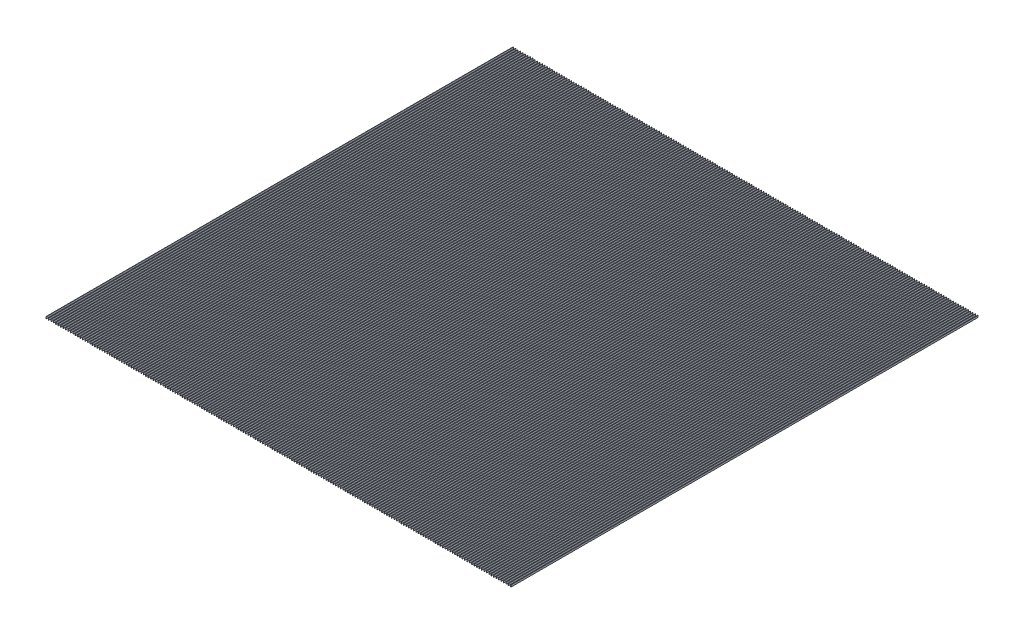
SolidWorks part; units mm, degrees
ref_plane "Front Plane" through (0, 0, 0) normal (0, 0, 1) x (1, 0, 0)
ref_plane "Top Plane" through (0, 0, 0) normal (0, 1, 0) x (1, 0, 0)
ref_plane "Right Plane" through (0, 0, 0) normal (1, 0, 0) x (0, 0, -1)
sketch "Sketch1" plane through (0, 0, 0) normal (0, 1, 0) x (1, 0, 0)
  line L0 (30.1625, 3048) -> (33.3375, 3048)
  line L1 (-1.5875, 3048) -> (1.5875, 3048)
  line L2 (-1.5875, 3048) -> (-1.5875, -3048)
  line L3 (-1.5875, -3048) -> (1.5875, -3048)
  line L4 (1.5875, 3048) -> (1.5875, -3048)
  line L5 (30.1625, 3048) -> (30.1625, -3048)
  line L6 (30.1625, -3048) -> (33.3375, -3048)
  line L7 (33.3375, 3048) -> (33.3375, -3048)
  line L8 (61.9125, 3048) -> (65.0875, 3048)
  line L9 (61.9125, 3048) -> (61.9125, -3048)
  line L10 (61.9125, -3048) -> (65.0875, -3048)
  line L11 (65.0875, 3048) -> (65.0875, -3048)
  line L12 (93.6625, 3048) -> (96.8375, 3048)
  line L13 (93.6625, 3048) -> (93.6625, -3048)
  line L14 (93.6625, -3048) -> (96.8375, -3048)
  line L15 (96.8375, 3048) -> (96.8375, -3048)
  line L16 (125.4125, 3048) -> (128.5875, 3048)
  line L17 (125.4125, 3048) -> (125.4125, -3048)
  line L18 (125.4125, -3048) -> (128.5875, -3048)
  line L19 (128.5875, 3048) -> (128.5875, -3048)
  line L20 (157.1625, 3048) -> (160.3375, 3048)
  line L21 (157.1625, 3048) -> (157.1625, -3048)
  line L22 (157.1625, -3048) -> (160.3375, -3048)
  line L23 (160.3375, 3048) -> (160.3375, -3048)
  line L24 (188.9125, 3048) -> (192.0875, 3048)
  line L25 (188.9125, 3048) -> (188.9125, -3048)
  line L26 (188.9125, -3048) -> (192.0875, -3048)
  line L27 (192.0875, 3048) -> (192.0875, -3048)
  line L28 (220.6625, 3048) -> (223.8375, 3048)
  line L29 (220.6625, 3048) -> (220.6625, -3048)
  line L30 (220.6625, -3048) -> (223.8375, -3048)
  line L31 (223.8375, 3048) -> (223.8375, -3048)
  line L32 (252.4125, 3048) -> (255.5875, 3048)
  line L33 (252.4125, 3048) -> (252.4125, -3048)
  line L34 (252.4125, -3048) -> (255.5875, -3048)
  line L35 (255.5875, 3048) -> (255.5875, -3048)
  line L36 (284.1625, 3048) -> (287.3375, 3048)
  line L37 (284.1625, 3048) -> (284.1625, -3048)
  line L38 (284.1625, -3048) -> (287.3375, -3048)
  line L39 (287.3375, 3048) -> (287.3375, -3048)
  line L40 (315.9125, 3048) -> (319.0875, 3048)
  line L41 (315.9125, 3048) -> (315.9125, -3048)
  line L42 (315.9125, -3048) -> (319.0875, -3048)
  line L43 (319.0875, 3048) -> (319.0875, -3048)
  line L44 (347.6625, 3048) -> (350.8375, 3048)
  line L45 (347.6625, 3048) -> (347.6625, -3048)
  line L46 (347.6625, -3048) -> (350.8375, -3048)
  line L47 (350.8375, 3048) -> (350.8375, -3048)
  line L48 (379.4125, 3048) -> (382.5875, 3048)
  line L49 (379.4125, 3048) -> (379.4125, -3048)
  line L50 (379.4125, -3048) -> (382.5875, -3048)
  line L51 (382.5875, 3048) -> (382.5875, -3048)
  line L52 (411.1625, 3048) -> (414.3375, 3048)
  line L53 (411.1625, 3048) -> (411.1625, -3048)
  line L54 (411.1625, -3048) -> (414.3375, -3048)
  line L55 (414.3375, 3048) -> (414.3375, -3048)
  line L56 (442.9125, 3048) -> (446.0875, 3048)
  line L57 (442.9125, 3048) -> (442.9125, -3048)
  line L58 (442.9125, -3048) -> (446.0875, -3048)
  line L59 (446.0875, 3048) -> (446.0875, -3048)
  line L60 (474.6625, 3048) -> (477.8375, 3048)
  line L61 (474.6625, 3048) -> (474.6625, -3048)
  line L62 (474.6625, -3048) -> (477.8375, -3048)
  line L63 (477.8375, 3048) -> (477.8375, -3048)
  line L64 (506.4125, 3048) -> (509.5875, 3048)
  line L65 (506.4125, 3048) -> (506.4125, -3048)
  line L66 (506.4125, -3048) -> (509.5875, -3048)
  line L67 (509.5875, 3048) -> (509.5875, -3048)
  line L68 (538.1625, 3048) -> (541.3375, 3048)
  line L69 (538.1625, 3048) -> (538.1625, -3048)
  line L70 (538.1625, -3048) -> (541.3375, -3048)
  line L71 (541.3375, 3048) -> (541.3375, -3048)
  line L72 (569.9125, 3048) -> (573.0875, 3048)
  line L73 (569.9125, 3048) -> (569.9125, -3048)
  line L74 (569.9125, -3048) -> (573.0875, -3048)
  line L75 (573.0875, 3048) -> (573.0875, -3048)
  line L76 (601.6625, 3048) -> (604.8375, 3048)
  line L77 (601.6625, 3048) -> (601.6625, -3048)
  line L78 (601.6625, -3048) -> (604.8375, -3048)
  line L79 (604.8375, 3048) -> (604.8375, -3048)
  line L80 (633.4125, 3048) -> (636.5875, 3048)
  line L81 (633.4125, 3048) -> (633.4125, -3048)
  line L82 (633.4125, -3048) -> (636.5875, -3048)
  line L83 (636.5875, 3048) -> (636.5875, -3048)
  line L84 (665.1625, 3048) -> (668.3375, 3048)
  line L85 (665.1625, 3048) -> (665.1625, -3048)
  line L86 (665.1625, -3048) -> (668.3375, -3048)
  line L87 (668.3375, 3048) -> (668.3375, -3048)
  line L88 (696.9125, 3048) -> (700.0875, 3048)
  line L89 (696.9125, 3048) -> (696.9125, -3048)
  line L90 (696.9125, -3048) -> (700.0875, -3048)
  line L91 (700.0875, 3048) -> (700.0875, -3048)
  line L92 (728.6625, 3048) -> (731.8375, 3048)
  line L93 (728.6625, 3048) -> (728.6625, -3048)
  line L94 (728.6625, -3048) -> (731.8375, -3048)
  line L95 (731.8375, 3048) -> (731.8375, -3048)
  line L96 (760.4125, 3048) -> (763.5875, 3048)
  line L97 (760.4125, 3048) -> (760.4125, -3048)
  line L98 (760.4125, -3048) -> (763.5875, -3048)
  line L99 (763.5875, 3048) -> (763.5875, -3048)
  line L100 (792.1625, 3048) -> (795.3375, 3048)
  line L101 (792.1625, 3048) -> (792.1625, -3048)
  line L102 (792.1625, -3048) -> (795.3375, -3048)
  line L103 (795.3375, 3048) -> (795.3375, -3048)
  line L104 (823.9125, 3048) -> (827.0875, 3048)
  line L105 (823.9125, 3048) -> (823.9125, -3048)
  line L106 (823.9125, -3048) -> (827.0875, -3048)
  line L107 (827.0875, 3048) -> (827.0875, -3048)
  line L108 (855.6625, 3048) -> (858.8375, 3048)
  line L109 (855.6625, 3048) -> (855.6625, -3048)
  line L110 (855.6625, -3048) -> (858.8375, -3048)
  line L111 (858.8375, 3048) -> (858.8375, -3048)
  line L112 (887.4125, 3048) -> (890.5875, 3048)
  line L113 (887.4125, 3048) -> (887.4125, -3048)
  line L114 (887.4125, -3048) -> (890.5875, -3048)
  line L115 (890.5875, 3048) -> (890.5875, -3048)
  line L116 (919.1625, 3048) -> (922.3375, 3048)
  line L117 (919.1625, 3048) -> (919.1625, -3048)
  line L118 (919.1625, -3048) -> (922.3375, -3048)
  line L119 (922.3375, 3048) -> (922.3375, -3048)
  line L120 (950.9125, 3048) -> (954.0875, 3048)
  line L121 (950.9125, 3048) -> (950.9125, -3048)
  line L122 (950.9125, -3048) -> (954.0875, -3048)
  line L123 (954.0875, 3048) -> (954.0875, -3048)
  line L124 (982.6625, 3048) -> (985.8375, 3048)
  line L125 (982.6625, 3048) -> (982.6625, -3048)
  line L126 (982.6625, -3048) -> (985.8375, -3048)
  line L127 (985.8375, 3048) -> (985.8375, -3048)
  line L128 (1014.4125, 3048) -> (1017.5875, 3048)
  line L129 (1014.4125, 3048) -> (1014.4125, -3048)
  line L130 (1014.4125, -3048) -> (1017.5875, -3048)
  line L131 (1017.5875, 3048) -> (1017.5875, -3048)
  line L132 (1046.1625, 3048) -> (1049.3375, 3048)
  line L133 (1046.1625, 3048) -> (1046.1625, -3048)
  line L134 (1046.1625, -3048) -> (1049.3375, -3048)
  line L135 (1049.3375, 3048) -> (1049.3375, -3048)
  line L136 (1077.9125, 3048) -> (1081.0875, 3048)
  line L137 (1077.9125, 3048) -> (1077.9125, -3048)
  line L138 (1077.9125, -3048) -> (1081.0875, -3048)
  line L139 (1081.0875, 3048) -> (1081.0875, -3048)
  line L140 (1109.6625, 3048) -> (1112.8375, 3048)
  line L141 (1109.6625, 3048) -> (1109.6625, -3048)
  line L142 (1109.6625, -3048) -> (1112.8375, -3048)
  line L143 (1112.8375, 3048) -> (1112.8375, -3048)
  line L144 (1141.4125, 3048) -> (1144.5875, 3048)
  line L145 (1141.4125, 3048) -> (1141.4125, -3048)
  line L146 (1141.4125, -3048) -> (1144.5875, -3048)
  line L147 (1144.5875, 3048) -> (1144.5875, -3048)
  line L148 (1173.1625, 3048) -> (1176.3375, 3048)
  line L149 (1173.1625, 3048) -> (1173.1625, -3048)
  line L150 (1173.1625, -3048) -> (1176.3375, -3048)
  line L151 (1176.3375, 3048) -> (1176.3375, -3048)
  line L152 (1204.9125, 3048) -> (1208.0875, 3048)
  line L153 (1204.9125, 3048) -> (1204.9125, -3048)
  line L154 (1204.9125, -3048) -> (1208.0875, -3048)
  line L155 (1208.0875, 3048) -> (1208.0875, -3048)
  line L156 (1236.6625, 3048) -> (1239.8375, 3048)
  line L157 (1236.6625, 3048) -> (1236.6625, -3048)
  line L158 (1236.6625, -3048) -> (1239.8375, -3048)
  line L159 (1239.8375, 3048) -> (1239.8375, -3048)
  line L160 (1268.4125, 3048) -> (1271.5875, 3048)
  line L161 (1268.4125, 3048) -> (1268.4125, -3048)
  line L162 (1268.4125, -3048) -> (1271.5875, -3048)
  line L163 (1271.5875, 3048) -> (1271.5875, -3048)
  line L164 (1300.1625, 3048) -> (1303.3375, 3048)
  line L165 (1300.1625, 3048) -> (1300.1625, -3048)
  line L166 (1300.1625, -3048) -> (1303.3375, -3048)
  line L167 (1303.3375, 3048) -> (1303.3375, -3048)
  line L168 (1331.9125, 3048) -> (1335.0875, 3048)
  line L169 (1331.9125, 3048) -> (1331.9125, -3048)
  line L170 (1331.9125, -3048) -> (1335.0875, -3048)
  line L171 (1335.0875, 3048) -> (1335.0875, -3048)
  line L172 (1363.6625, 3048) -> (1366.8375, 3048)
  line L173 (1363.6625, 3048) -> (1363.6625, -3048)
  line L174 (1363.6625, -3048) -> (1366.8375, -3048)
  line L175 (1366.8375, 3048) -> (1366.8375, -3048)
  line L176 (1395.4125, 3048) -> (1398.5875, 3048)
  line L177 (1395.4125, 3048) -> (1395.4125, -3048)
  line L178 (1395.4125, -3048) -> (1398.5875, -3048)
  line L179 (1398.5875, 3048) -> (1398.5875, -3048)
  line L180 (1427.1625, 3048) -> (1430.3375, 3048)
  line L181 (1427.1625, 3048) -> (1427.1625, -3048)
  line L182 (1427.1625, -3048) -> (1430.3375, -3048)
  line L183 (1430.3375, 3048) -> (1430.3375, -3048)
  line L184 (1458.9125, 3048) -> (1462.0875, 3048)
  line L185 (1458.9125, 3048) -> (1458.9125, -3048)
  line L186 (1458.9125, -3048) -> (1462.0875, -3048)
  line L187 (1462.0875, 3048) -> (1462.0875, -3048)
  line L188 (1490.6625, 3048) -> (1493.8375, 3048)
  line L189 (1490.6625, 3048) -> (1490.6625, -3048)
  line L190 (1490.6625, -3048) -> (1493.8375, -3048)
  line L191 (1493.8375, 3048) -> (1493.8375, -3048)
  line L192 (1522.4125, 3048) -> (1525.5875, 3048)
  line L193 (1522.4125, 3048) -> (1522.4125, -3048)
  line L194 (1522.4125, -3048) -> (1525.5875, -3048)
  line L195 (1525.5875, 3048) -> (1525.5875, -3048)
  line L196 (1554.1625, 3048) -> (1557.3375, 3048)
  line L197 (1554.1625, 3048) -> (1554.1625, -3048)
  line L198 (1554.1625, -3048) -> (1557.3375, -3048)
  line L199 (1557.3375, 3048) -> (1557.3375, -3048)
  line L200 (1585.9125, 3048) -> (1589.0875, 3048)
  line L201 (1585.9125, 3048) -> (1585.9125, -3048)
  line L202 (1585.9125, -3048) -> (1589.0875, -3048)
  line L203 (1589.0875, 3048) -> (1589.0875, -3048)
  line L204 (1617.6625, 3048) -> (1620.8375, 3048)
  line L205 (1617.6625, 3048) -> (1617.6625, -3048)
  line L206 (1617.6625, -3048) -> (1620.8375, -3048)
  line L207 (1620.8375, 3048) -> (1620.8375, -3048)
  line L208 (1649.4125, 3048) -> (1652.5875, 3048)
  line L209 (1649.4125, 3048) -> (1649.4125, -3048)
  line L210 (1649.4125, -3048) -> (1652.5875, -3048)
  line L211 (1652.5875, 3048) -> (1652.5875, -3048)
  line L212 (1681.1625, 3048) -> (1684.3375, 3048)
  line L213 (1681.1625, 3048) -> (1681.1625, -3048)
  line L214 (1681.1625, -3048) -> (1684.3375, -3048)
  line L215 (1684.3375, 3048) -> (1684.3375, -3048)
  line L216 (1712.9125, 3048) -> (1716.0875, 3048)
  line L217 (1712.9125, 3048) -> (1712.9125, -3048)
  line L218 (1712.9125, -3048) -> (1716.0875, -3048)
  line L219 (1716.0875, 3048) -> (1716.0875, -3048)
  line L220 (1744.6625, 3048) -> (1747.8375, 3048)
  line L221 (1744.6625, 3048) -> (1744.6625, -3048)
  line L222 (1744.6625, -3048) -> (1747.8375, -3048)
  line L223 (1747.8375, 3048) -> (1747.8375, -3048)
  line L224 (1776.4125, 3048) -> (1779.5875, 3048)
  line L225 (1776.4125, 3048) -> (1776.4125, -3048)
  line L226 (1776.4125, -3048) -> (1779.5875, -3048)
  line L227 (1779.5875, 3048) -> (1779.5875, -3048)
  line L228 (1808.1625, 3048) -> (1811.3375, 3048)
  line L229 (1808.1625, 3048) -> (1808.1625, -3048)
  line L230 (1808.1625, -3048) -> (1811.3375, -3048)
  line L231 (1811.3375, 3048) -> (1811.3375, -3048)
  line L232 (1839.9125, 3048) -> (1843.0875, 3048)
  line L233 (1839.9125, 3048) -> (1839.9125, -3048)
  line L234 (1839.9125, -3048) -> (1843.0875, -3048)
  line L235 (1843.0875, 3048) -> (1843.0875, -3048)
  line L236 (1871.6625, 3048) -> (1874.8375, 3048)
  line L237 (1871.6625, 3048) -> (1871.6625, -3048)
  line L238 (1871.6625, -3048) -> (1874.8375, -3048)
  line L239 (1874.8375, 3048) -> (1874.8375, -3048)
  line L240 (1903.4125, 3048) -> (1906.5875, 3048)
  line L241 (1903.4125, 3048) -> (1903.4125, -3048)
  line L242 (1903.4125, -3048) -> (1906.5875, -3048)
  line L243 (1906.5875, 3048) -> (1906.5875, -3048)
  line L244 (1935.1625, 3048) -> (1938.3375, 3048)
  line L245 (1935.1625, 3048) -> (1935.1625, -3048)
  line L246 (1935.1625, -3048) -> (1938.3375, -3048)
  line L247 (1938.3375, 3048) -> (1938.3375, -3048)
  line L248 (1966.9125, 3048) -> (1970.0875, 3048)
  line L249 (1966.9125, 3048) -> (1966.9125, -3048)
  line L250 (1966.9125, -3048) -> (1970.0875, -3048)
  line L251 (1970.0875, 3048) -> (1970.0875, -3048)
  line L252 (1998.6625, 3048) -> (2001.8375, 3048)
  line L253 (1998.6625, 3048) -> (1998.6625, -3048)
  line L254 (1998.6625, -3048) -> (2001.8375, -3048)
  line L255 (2001.8375, 3048) -> (2001.8375, -3048)
  line L256 (2030.4125, 3048) -> (2033.5875, 3048)
  line L257 (2030.4125, 3048) -> (2030.4125, -3048)
  line L258 (2030.4125, -3048) -> (2033.5875, -3048)
  line L259 (2033.5875, 3048) -> (2033.5875, -3048)
  line L260 (2062.1625, 3048) -> (2065.3375, 3048)
  line L261 (2062.1625, 3048) -> (2062.1625, -3048)
  line L262 (2062.1625, -3048) -> (2065.3375, -3048)
  line L263 (2065.3375, 3048) -> (2065.3375, -3048)
  line L264 (2093.9125, 3048) -> (2097.0875, 3048)
  line L265 (2093.9125, 3048) -> (2093.9125, -3048)
  line L266 (2093.9125, -3048) -> (2097.0875, -3048)
  line L267 (2097.0875, 3048) -> (2097.0875, -3048)
  line L268 (2125.6625, 3048) -> (2128.8375, 3048)
  line L269 (2125.6625, 3048) -> (2125.6625, -3048)
  line L270 (2125.6625, -3048) -> (2128.8375, -3048)
  line L271 (2128.8375, 3048) -> (2128.8375, -3048)
  line L272 (2157.4125, 3048) -> (2160.5875, 3048)
  line L273 (2157.4125, 3048) -> (2157.4125, -3048)
  line L274 (2157.4125, -3048) -> (2160.5875, -3048)
  line L275 (2160.5875, 3048) -> (2160.5875, -3048)
  line L276 (2189.1625, 3048) -> (2192.3375, 3048)
  line L277 (2189.1625, 3048) -> (2189.1625, -3048)
  line L278 (2189.1625, -3048) -> (2192.3375, -3048)
  line L279 (2192.3375, 3048) -> (2192.3375, -3048)
  line L280 (2220.9125, 3048) -> (2224.0875, 3048)
  line L281 (2220.9125, 3048) -> (2220.9125, -3048)
  line L282 (2220.9125, -3048) -> (2224.0875, -3048)
  line L283 (2224.0875, 3048) -> (2224.0875, -3048)
  line L284 (2252.6625, 3048) -> (2255.8375, 3048)
  line L285 (2252.6625, 3048) -> (2252.6625, -3048)
  line L286 (2252.6625, -3048) -> (2255.8375, -3048)
  line L287 (2255.8375, 3048) -> (2255.8375, -3048)
  line L288 (2284.4125, 3048) -> (2287.5875, 3048)
  line L289 (2284.4125, 3048) -> (2284.4125, -3048)
  line L290 (2284.4125, -3048) -> (2287.5875, -3048)
  line L291 (2287.5875, 3048) -> (2287.5875, -3048)
  line L292 (2316.1625, 3048) -> (2319.3375, 3048)
  line L293 (2316.1625, 3048) -> (2316.1625, -3048)
  line L294 (2316.1625, -3048) -> (2319.3375, -3048)
  line L295 (2319.3375, 3048) -> (2319.3375, -3048)
  line L296 (2347.9125, 3048) -> (2351.0875, 3048)
  line L297 (2347.9125, 3048) -> (2347.9125, -3048)
  line L298 (2347.9125, -3048) -> (2351.0875, -3048)
  line L299 (2351.0875, 3048) -> (2351.0875, -3048)
  line L300 (2379.6625, 3048) -> (2382.8375, 3048)
  line L301 (2379.6625, 3048) -> (2379.6625, -3048)
  line L302 (2379.6625, -3048) -> (2382.8375, -3048)
  line L303 (2382.8375, 3048) -> (2382.8375, -3048)
  line L304 (2411.4125, 3048) -> (2414.5875, 3048)
  line L305 (2411.4125, 3048) -> (2411.4125, -3048)
  line L306 (2411.4125, -3048) -> (2414.5875, -3048)
  line L307 (2414.5875, 3048) -> (2414.5875, -3048)
  line L308 (2443.1625, 3048) -> (2446.3375, 3048)
  line L309 (2443.1625, 3048) -> (2443.1625, -3048)
  line L310 (2443.1625, -3048) -> (2446.3375, -3048)
  line L311 (2446.3375, 3048) -> (2446.3375, -3048)
  line L312 (2474.9125, 3048) -> (2478.0875, 3048)
  line L313 (2474.9125, 3048) -> (2474.9125, -3048)
  line L314 (2474.9125, -3048) -> (2478.0875, -3048)
  line L315 (2478.0875, 3048) -> (2478.0875, -3048)
  line L316 (2506.6625, 3048) -> (2509.8375, 3048)
  line L317 (2506.6625, 3048) -> (2506.6625, -3048)
  line L318 (2506.6625, -3048) -> (2509.8375, -3048)
  line L319 (2509.8375, 3048) -> (2509.8375, -3048)
  line L320 (2538.4125, 3048) -> (2541.5875, 3048)
  line L321 (2538.4125, 3048) -> (2538.4125, -3048)
  line L322 (2538.4125, -3048) -> (2541.5875, -3048)
  line L323 (2541.5875, 3048) -> (2541.5875, -3048)
  line L324 (2570.1625, 3048) -> (2573.3375, 3048)
  line L325 (2570.1625, 3048) -> (2570.1625, -3048)
  line L326 (2570.1625, -3048) -> (2573.3375, -3048)
  line L327 (2573.3375, 3048) -> (2573.3375, -3048)
  line L328 (2601.9125, 3048) -> (2605.0875, 3048)
  line L329 (2601.9125, 3048) -> (2601.9125, -3048)
  line L330 (2601.9125, -3048) -> (2605.0875, -3048)
  line L331 (2605.0875, 3048) -> (2605.0875, -3048)
  line L332 (2633.6625, 3048) -> (2636.8375, 3048)
  line L333 (2633.6625, 3048) -> (2633.6625, -3048)
  line L334 (2633.6625, -3048) -> (2636.8375, -3048)
  line L335 (2636.8375, 3048) -> (2636.8375, -3048)
  line L336 (2665.4125, 3048) -> (2668.5875, 3048)
  line L337 (2665.4125, 3048) -> (2665.4125, -3048)
  line L338 (2665.4125, -3048) -> (2668.5875, -3048)
  line L339 (2668.5875, 3048) -> (2668.5875, -3048)
  line L340 (2697.1625, 3048) -> (2700.3375, 3048)
  line L341 (2697.1625, 3048) -> (2697.1625, -3048)
  line L342 (2697.1625, -3048) -> (2700.3375, -3048)
  line L343 (2700.3375, 3048) -> (2700.3375, -3048)
  line L344 (2728.9125, 3048) -> (2732.0875, 3048)
  line L345 (2728.9125, 3048) -> (2728.9125, -3048)
  line L346 (2728.9125, -3048) -> (2732.0875, -3048)
  line L347 (2732.0875, 3048) -> (2732.0875, -3048)
  line L348 (2760.6625, 3048) -> (2763.8375, 3048)
  line L349 (2760.6625, 3048) -> (2760.6625, -3048)
  line L350 (2760.6625, -3048) -> (2763.8375, -3048)
  line L351 (2763.8375, 3048) -> (2763.8375, -3048)
  line L352 (2792.4125, 3048) -> (2795.5875, 3048)
  line L353 (2792.4125, 3048) -> (2792.4125, -3048)
  line L354 (2792.4125, -3048) -> (2795.5875, -3048)
  line L355 (2795.5875, 3048) -> (2795.5875, -3048)
  line L356 (2824.1625, 3048) -> (2827.3375, 3048)
  line L357 (2824.1625, 3048) -> (2824.1625, -3048)
  line L358 (2824.1625, -3048) -> (2827.3375, -3048)
  line L359 (2827.3375, 3048) -> (2827.3375, -3048)
  line L360 (2855.9125, 3048) -> (2859.0875, 3048)
  line L361 (2855.9125, 3048) -> (2855.9125, -3048)
  line L362 (2855.9125, -3048) -> (2859.0875, -3048)
  line L363 (2859.0875, 3048) -> (2859.0875, -3048)
  line L364 (2887.6625, 3048) -> (2890.8375, 3048)
  line L365 (2887.6625, 3048) -> (2887.6625, -3048)
  line L366 (2887.6625, -3048) -> (2890.8375, -3048)
  line L367 (2890.8375, 3048) -> (2890.8375, -3048)
  line L368 (2919.4125, 3048) -> (2922.5875, 3048)
  line L369 (2919.4125, 3048) -> (2919.4125, -3048)
  line L370 (2919.4125, -3048) -> (2922.5875, -3048)
  line L371 (2922.5875, 3048) -> (2922.5875, -3048)
  line L372 (2951.1625, 3048) -> (2954.3375, 3048)
  line L373 (2951.1625, 3048) -> (2951.1625, -3048)
  line L374 (2951.1625, -3048) -> (2954.3375, -3048)
  line L375 (2954.3375, 3048) -> (2954.3375, -3048)
  line L376 (2982.9125, 3048) -> (2986.0875, 3048)
  line L377 (2982.9125, 3048) -> (2982.9125, -3048)
  line L378 (2982.9125, -3048) -> (2986.0875, -3048)
  line L379 (2986.0875, 3048) -> (2986.0875, -3048)
  line L380 (3014.6625, 3048) -> (3017.8375, 3048)
  line L381 (3014.6625, 3048) -> (3014.6625, -3048)
  line L382 (3014.6625, -3048) -> (3017.8375, -3048)
  line L383 (3017.8375, 3048) -> (3017.8375, -3048)
  line L384 (3046.4125, 3048) -> (3049.5875, 3048)
  line L385 (3046.4125, 3048) -> (3046.4125, -3048)
  line L386 (3046.4125, -3048) -> (3049.5875, -3048)
  line L387 (3049.5875, 3048) -> (3049.5875, -3048)
  line L388 (3078.1625, 3048) -> (3081.3375, 3048)
  line L389 (3078.1625, 3048) -> (3078.1625, -3048)
  line L390 (3078.1625, -3048) -> (3081.3375, -3048)
  line L391 (3081.3375, 3048) -> (3081.3375, -3048)
  line L392 (3109.9125, 3048) -> (3113.0875, 3048)
  line L393 (3109.9125, 3048) -> (3109.9125, -3048)
  line L394 (3109.9125, -3048) -> (3113.0875, -3048)
  line L395 (3113.0875, 3048) -> (3113.0875, -3048)
  line L396 (3141.6625, 3048) -> (3144.8375, 3048)
  line L397 (3141.6625, 3048) -> (3141.6625, -3048)
  line L398 (3141.6625, -3048) -> (3144.8375, -3048)
  line L399 (3144.8375, 3048) -> (3144.8375, -3048)
  line L400 (3173.4125, 3048) -> (3176.5875, 3048)
  line L401 (3173.4125, 3048) -> (3173.4125, -3048)
  line L402 (3173.4125, -3048) -> (3176.5875, -3048)
  line L403 (3176.5875, 3048) -> (3176.5875, -3048)
  line L404 (3205.1625, 3048) -> (3208.3375, 3048)
  line L405 (3205.1625, 3048) -> (3205.1625, -3048)
  line L406 (3205.1625, -3048) -> (3208.3375, -3048)
  line L407 (3208.3375, 3048) -> (3208.3375, -3048)
  line L408 (3236.9125, 3048) -> (3240.0875, 3048)
  line L409 (3236.9125, 3048) -> (3236.9125, -3048)
  line L410 (3236.9125, -3048) -> (3240.0875, -3048)
  line L411 (3240.0875, 3048) -> (3240.0875, -3048)
  line L412 (3268.6625, 3048) -> (3271.8375, 3048)
  line L413 (3268.6625, 3048) -> (3268.6625, -3048)
  line L414 (3268.6625, -3048) -> (3271.8375, -3048)
  line L415 (3271.8375, 3048) -> (3271.8375, -3048)
  line L416 (3300.4125, 3048) -> (3303.5875, 3048)
  line L417 (3300.4125, 3048) -> (3300.4125, -3048)
  line L418 (3300.4125, -3048) -> (3303.5875, -3048)
  line L419 (3303.5875, 3048) -> (3303.5875, -3048)
  line L420 (3332.1625, 3048) -> (3335.3375, 3048)
  line L421 (3332.1625, 3048) -> (3332.1625, -3048)
  line L422 (3332.1625, -3048) -> (3335.3375, -3048)
  line L423 (3335.3375, 3048) -> (3335.3375, -3048)
  line L424 (3363.9125, 3048) -> (3367.0875, 3048)
  line L425 (3363.9125, 3048) -> (3363.9125, -3048)
  line L426 (3363.9125, -3048) -> (3367.0875, -3048)
  line L427 (3367.0875, 3048) -> (3367.0875, -3048)
  line L428 (3395.6625, 3048) -> (3398.8375, 3048)
  line L429 (3395.6625, 3048) -> (3395.6625, -3048)
  line L430 (3395.6625, -3048) -> (3398.8375, -3048)
  line L431 (3398.8375, 3048) -> (3398.8375, -3048)
  line L432 (3427.4125, 3048) -> (3430.5875, 3048)
  line L433 (3427.4125, 3048) -> (3427.4125, -3048)
  line L434 (3427.4125, -3048) -> (3430.5875, -3048)
  line L435 (3430.5875, 3048) -> (3430.5875, -3048)
  line L436 (3459.1625, 3048) -> (3462.3375, 3048)
  line L437 (3459.1625, 3048) -> (3459.1625, -3048)
  line L438 (3459.1625, -3048) -> (3462.3375, -3048)
  line L439 (3462.3375, 3048) -> (3462.3375, -3048)
  line L440 (3490.9125, 3048) -> (3494.0875, 3048)
  line L441 (3490.9125, 3048) -> (3490.9125, -3048)
  line L442 (3490.9125, -3048) -> (3494.0875, -3048)
  line L443 (3494.0875, 3048) -> (3494.0875, -3048)
  line L444 (3522.6625, 3048) -> (3525.8375, 3048)
  line L445 (3522.6625, 3048) -> (3522.6625, -3048)
  line L446 (3522.6625, -3048) -> (3525.8375, -3048)
  line L447 (3525.8375, 3048) -> (3525.8375, -3048)
  line L448 (3554.4125, 3048) -> (3557.5875, 3048)
  line L449 (3554.4125, 3048) -> (3554.4125, -3048)
  line L450 (3554.4125, -3048) -> (3557.5875, -3048)
  line L451 (3557.5875, 3048) -> (3557.5875, -3048)
  line L452 (3586.1625, 3048) -> (3589.3375, 3048)
  line L453 (3586.1625, 3048) -> (3586.1625, -3048)
  line L454 (3586.1625, -3048) -> (3589.3375, -3048)
  line L455 (3589.3375, 3048) -> (3589.3375, -3048)
  line L456 (3617.9125, 3048) -> (3621.0875, 3048)
  line L457 (3617.9125, 3048) -> (3617.9125, -3048)
  line L458 (3617.9125, -3048) -> (3621.0875, -3048)
  line L459 (3621.0875, 3048) -> (3621.0875, -3048)
  line L460 (3649.6625, 3048) -> (3652.8375, 3048)
  line L461 (3649.6625, 3048) -> (3649.6625, -3048)
  line L462 (3649.6625, -3048) -> (3652.8375, -3048)
  line L463 (3652.8375, 3048) -> (3652.8375, -3048)
  line L464 (3681.4125, 3048) -> (3684.5875, 3048)
  line L465 (3681.4125, 3048) -> (3681.4125, -3048)
  line L466 (3681.4125, -3048) -> (3684.5875, -3048)
  line L467 (3684.5875, 3048) -> (3684.5875, -3048)
  line L468 (3713.1625, 3048) -> (3716.3375, 3048)
  line L469 (3713.1625, 3048) -> (3713.1625, -3048)
  line L470 (3713.1625, -3048) -> (3716.3375, -3048)
  line L471 (3716.3375, 3048) -> (3716.3375, -3048)
  line L472 (3744.9125, 3048) -> (3748.0875, 3048)
  line L473 (3744.9125, 3048) -> (3744.9125, -3048)
  line L474 (3744.9125, -3048) -> (3748.0875, -3048)
  line L475 (3748.0875, 3048) -> (3748.0875, -3048)
  line L476 (3776.6625, 3048) -> (3779.8375, 3048)
  line L477 (3776.6625, 3048) -> (3776.6625, -3048)
  line L478 (3776.6625, -3048) -> (3779.8375, -3048)
  line L479 (3779.8375, 3048) -> (3779.8375, -3048)
  line L480 (3808.4125, 3048) -> (3811.5875, 3048)
  line L481 (3808.4125, 3048) -> (3808.4125, -3048)
  line L482 (3808.4125, -3048) -> (3811.5875, -3048)
  line L483 (3811.5875, 3048) -> (3811.5875, -3048)
  line L484 (3840.1625, 3048) -> (3843.3375, 3048)
  line L485 (3840.1625, 3048) -> (3840.1625, -3048)
  line L486 (3840.1625, -3048) -> (3843.3375, -3048)
  line L487 (3843.3375, 3048) -> (3843.3375, -3048)
  line L488 (3871.9125, 3048) -> (3875.0875, 3048)
  line L489 (3871.9125, 3048) -> (3871.9125, -3048)
  line L490 (3871.9125, -3048) -> (3875.0875, -3048)
  line L491 (3875.0875, 3048) -> (3875.0875, -3048)
  line L492 (3903.6625, 3048) -> (3906.8375, 3048)
  line L493 (3903.6625, 3048) -> (3903.6625, -3048)
  line L494 (3903.6625, -3048) -> (3906.8375, -3048)
  line L495 (3906.8375, 3048) -> (3906.8375, -3048)
  line L496 (3935.4125, 3048) -> (3938.5875, 3048)
  line L497 (3935.4125, 3048) -> (3935.4125, -3048)
  line L498 (3935.4125, -3048) -> (3938.5875, -3048)
  line L499 (3938.5875, 3048) -> (3938.5875, -3048)
  line L500 (3967.1625, 3048) -> (3970.3375, 3048)
  line L501 (3967.1625, 3048) -> (3967.1625, -3048)
  line L502 (3967.1625, -3048) -> (3970.3375, -3048)
  line L503 (3970.3375, 3048) -> (3970.3375, -3048)
  line L504 (3998.9125, 3048) -> (4002.0875, 3048)
  line L505 (3998.9125, 3048) -> (3998.9125, -3048)
  line L506 (3998.9125, -3048) -> (4002.0875, -3048)
  line L507 (4002.0875, 3048) -> (4002.0875, -3048)
  line L508 (4030.6625, 3048) -> (4033.8375, 3048)
  line L509 (4030.6625, 3048) -> (4030.6625, -3048)
  line L510 (4030.6625, -3048) -> (4033.8375, -3048)
  line L511 (4033.8375, 3048) -> (4033.8375, -3048)
  line L512 (4062.4125, 3048) -> (4065.5875, 3048)
  line L513 (4062.4125, 3048) -> (4062.4125, -3048)
  line L514 (4062.4125, -3048) -> (4065.5875, -3048)
  line L515 (4065.5875, 3048) -> (4065.5875, -3048)
  line L516 (4094.1625, 3048) -> (4097.3375, 3048)
  line L517 (4094.1625, 3048) -> (4094.1625, -3048)
  line L518 (4094.1625, -3048) -> (4097.3375, -3048)
  line L519 (4097.3375, 3048) -> (4097.3375, -3048)
  line L520 (4125.9125, 3048) -> (4129.0875, 3048)
  line L521 (4125.9125, 3048) -> (4125.9125, -3048)
  line L522 (4125.9125, -3048) -> (4129.0875, -3048)
  line L523 (4129.0875, 3048) -> (4129.0875, -3048)
  line L524 (4157.6625, 3048) -> (4160.8375, 3048)
  line L525 (4157.6625, 3048) -> (4157.6625, -3048)
  line L526 (4157.6625, -3048) -> (4160.8375, -3048)
  line L527 (4160.8375, 3048) -> (4160.8375, -3048)
  line L528 (4189.4125, 3048) -> (4192.5875, 3048)
  line L529 (4189.4125, 3048) -> (4189.4125, -3048)
  line L530 (4189.4125, -3048) -> (4192.5875, -3048)
  line L531 (4192.5875, 3048) -> (4192.5875, -3048)
  line L532 (4221.1625, 3048) -> (4224.3375, 3048)
  line L533 (4221.1625, 3048) -> (4221.1625, -3048)
  line L534 (4221.1625, -3048) -> (4224.3375, -3048)
  line L535 (4224.3375, 3048) -> (4224.3375, -3048)
  line L536 (4252.9125, 3048) -> (4256.0875, 3048)
  line L537 (4252.9125, 3048) -> (4252.9125, -3048)
  line L538 (4252.9125, -3048) -> (4256.0875, -3048)
  line L539 (4256.0875, 3048) -> (4256.0875, -3048)
  line L540 (4284.6625, 3048) -> (4287.8375, 3048)
  line L541 (4284.6625, 3048) -> (4284.6625, -3048)
  line L542 (4284.6625, -3048) -> (4287.8375, -3048)
  line L543 (4287.8375, 3048) -> (4287.8375, -3048)
  line L544 (4316.4125, 3048) -> (4319.5875, 3048)
  line L545 (4316.4125, 3048) -> (4316.4125, -3048)
  line L546 (4316.4125, -3048) -> (4319.5875, -3048)
  line L547 (4319.5875, 3048) -> (4319.5875, -3048)
  line L548 (4348.1625, 3048) -> (4351.3375, 3048)
  line L549 (4348.1625, 3048) -> (4348.1625, -3048)
  line L550 (4348.1625, -3048) -> (4351.3375, -3048)
  line L551 (4351.3375, 3048) -> (4351.3375, -3048)
  line L552 (4379.9125, 3048) -> (4383.0875, 3048)
  line L553 (4379.9125, 3048) -> (4379.9125, -3048)
  line L554 (4379.9125, -3048) -> (4383.0875, -3048)
  line L555 (4383.0875, 3048) -> (4383.0875, -3048)
  line L556 (4411.6625, 3048) -> (4414.8375, 3048)
  line L557 (4411.6625, 3048) -> (4411.6625, -3048)
  line L558 (4411.6625, -3048) -> (4414.8375, -3048)
  line L559 (4414.8375, 3048) -> (4414.8375, -3048)
  line L560 (4443.4125, 3048) -> (4446.5875, 3048)
  line L561 (4443.4125, 3048) -> (4443.4125, -3048)
  line L562 (4443.4125, -3048) -> (4446.5875, -3048)
  line L563 (4446.5875, 3048) -> (4446.5875, -3048)
  line L564 (4475.1625, 3048) -> (4478.3375, 3048)
  line L565 (4475.1625, 3048) -> (4475.1625, -3048)
  line L566 (4475.1625, -3048) -> (4478.3375, -3048)
  line L567 (4478.3375, 3048) -> (4478.3375, -3048)
  line L568 (4506.9125, 3048) -> (4510.0875, 3048)
  line L569 (4506.9125, 3048) -> (4506.9125, -3048)
  line L570 (4506.9125, -3048) -> (4510.0875, -3048)
  line L571 (4510.0875, 3048) -> (4510.0875, -3048)
  line L572 (4538.6625, 3048) -> (4541.8375, 3048)
  line L573 (4538.6625, 3048) -> (4538.6625, -3048)
  line L574 (4538.6625, -3048) -> (4541.8375, -3048)
  line L575 (4541.8375, 3048) -> (4541.8375, -3048)
  line L576 (4570.4125, 3048) -> (4573.5875, 3048)
  line L577 (4570.4125, 3048) -> (4570.4125, -3048)
  line L578 (4570.4125, -3048) -> (4573.5875, -3048)
  line L579 (4573.5875, 3048) -> (4573.5875, -3048)
  line L580 (4602.1625, 3048) -> (4605.3375, 3048)
  line L581 (4602.1625, 3048) -> (4602.1625, -3048)
  line L582 (4602.1625, -3048) -> (4605.3375, -3048)
  line L583 (4605.3375, 3048) -> (4605.3375, -3048)
  line L584 (4633.9125, 3048) -> (4637.0875, 3048)
  line L585 (4633.9125, 3048) -> (4633.9125, -3048)
  line L586 (4633.9125, -3048) -> (4637.0875, -3048)
  line L587 (4637.0875, 3048) -> (4637.0875, -3048)
  line L588 (4665.6625, 3048) -> (4668.8375, 3048)
  line L589 (4665.6625, 3048) -> (4665.6625, -3048)
  line L590 (4665.6625, -3048) -> (4668.8375, -3048)
  line L591 (4668.8375, 3048) -> (4668.8375, -3048)
  line L592 (4697.4125, 3048) -> (4700.5875, 3048)
  line L593 (4697.4125, 3048) -> (4697.4125, -3048)
  line L594 (4697.4125, -3048) -> (4700.5875, -3048)
  line L595 (4700.5875, 3048) -> (4700.5875, -3048)
  line L596 (4729.1625, 3048) -> (4732.3375, 3048)
  line L597 (4729.1625, 3048) -> (4729.1625, -3048)
  line L598 (4729.1625, -3048) -> (4732.3375, -3048)
  line L599 (4732.3375, 3048) -> (4732.3375, -3048)
  line L600 (4760.9125, 3048) -> (4764.0875, 3048)
  line L601 (4760.9125, 3048) -> (4760.9125, -3048)
  line L602 (4760.9125, -3048) -> (4764.0875, -3048)
  line L603 (4764.0875, 3048) -> (4764.0875, -3048)
  line L604 (4792.6625, 3048) -> (4795.8375, 3048)
  line L605 (4792.6625, 3048) -> (4792.6625, -3048)
  line L606 (4792.6625, -3048) -> (4795.8375, -3048)
  line L607 (4795.8375, 3048) -> (4795.8375, -3048)
  line L608 (4824.4125, 3048) -> (4827.5875, 3048)
  line L609 (4824.4125, 3048) -> (4824.4125, -3048)
  line L610 (4824.4125, -3048) -> (4827.5875, -3048)
  line L611 (4827.5875, 3048) -> (4827.5875, -3048)
  line L612 (4856.1625, 3048) -> (4859.3375, 3048)
  line L613 (4856.1625, 3048) -> (4856.1625, -3048)
  line L614 (4856.1625, -3048) -> (4859.3375, -3048)
  line L615 (4859.3375, 3048) -> (4859.3375, -3048)
  line L616 (4887.9125, 3048) -> (4891.0875, 3048)
  line L617 (4887.9125, 3048) -> (4887.9125, -3048)
  line L618 (4887.9125, -3048) -> (4891.0875, -3048)
  line L619 (4891.0875, 3048) -> (4891.0875, -3048)
  line L620 (4919.6625, 3048) -> (4922.8375, 3048)
  line L621 (4919.6625, 3048) -> (4919.6625, -3048)
  line L622 (4919.6625, -3048) -> (4922.8375, -3048)
  line L623 (4922.8375, 3048) -> (4922.8375, -3048)
  line L624 (4951.4125, 3048) -> (4954.5875, 3048)
  line L625 (4951.4125, 3048) -> (4951.4125, -3048)
  line L626 (4951.4125, -3048) -> (4954.5875, -3048)
  line L627 (4954.5875, 3048) -> (4954.5875, -3048)
  line L628 (4983.1625, 3048) -> (4986.3375, 3048)
  line L629 (4983.1625, 3048) -> (4983.1625, -3048)
  line L630 (4983.1625, -3048) -> (4986.3375, -3048)
  line L631 (4986.3375, 3048) -> (4986.3375, -3048)
  line L632 (5014.9125, 3048) -> (5018.0875, 3048)
  line L633 (5014.9125, 3048) -> (5014.9125, -3048)
  line L634 (5014.9125, -3048) -> (5018.0875, -3048)
  line L635 (5018.0875, 3048) -> (5018.0875, -3048)
  line L636 (5046.6625, 3048) -> (5049.8375, 3048)
  line L637 (5046.6625, 3048) -> (5046.6625, -3048)
  line L638 (5046.6625, -3048) -> (5049.8375, -3048)
  line L639 (5049.8375, 3048) -> (5049.8375, -3048)
  line L640 (5078.4125, 3048) -> (5081.5875, 3048)
  line L641 (5078.4125, 3048) -> (5078.4125, -3048)
  line L642 (5078.4125, -3048) -> (5081.5875, -3048)
  line L643 (5081.5875, 3048) -> (5081.5875, -3048)
  line L644 (5110.1625, 3048) -> (5113.3375, 3048)
  line L645 (5110.1625, 3048) -> (5110.1625, -3048)
  line L646 (5110.1625, -3048) -> (5113.3375, -3048)
  line L647 (5113.3375, 3048) -> (5113.3375, -3048)
  line L648 (5141.9125, 3048) -> (5145.0875, 3048)
  line L649 (5141.9125, 3048) -> (5141.9125, -3048)
  line L650 (5141.9125, -3048) -> (5145.0875, -3048)
  line L651 (5145.0875, 3048) -> (5145.0875, -3048)
  line L652 (5173.6625, 3048) -> (5176.8375, 3048)
  line L653 (5173.6625, 3048) -> (5173.6625, -3048)
  line L654 (5173.6625, -3048) -> (5176.8375, -3048)
  line L655 (5176.8375, 3048) -> (5176.8375, -3048)
  line L656 (5205.4125, 3048) -> (5208.5875, 3048)
  line L657 (5205.4125, 3048) -> (5205.4125, -3048)
  line L658 (5205.4125, -3048) -> (5208.5875, -3048)
  line L659 (5208.5875, 3048) -> (5208.5875, -3048)
  line L660 (5237.1625, 3048) -> (5240.3375, 3048)
  line L661 (5237.1625, 3048) -> (5237.1625, -3048)
  line L662 (5237.1625, -3048) -> (5240.3375, -3048)
  line L663 (5240.3375, 3048) -> (5240.3375, -3048)
  line L664 (5268.9125, 3048) -> (5272.0875, 3048)
  line L665 (5268.9125, 3048) -> (5268.9125, -3048)
  line L666 (5268.9125, -3048) -> (5272.0875, -3048)
  line L667 (5272.0875, 3048) -> (5272.0875, -3048)
  line L668 (5300.6625, 3048) -> (5303.8375, 3048)
  line L669 (5300.6625, 3048) -> (5300.6625, -3048)
  line L670 (5300.6625, -3048) -> (5303.8375, -3048)
  line L671 (5303.8375, 3048) -> (5303.8375, -3048)
  line L672 (5332.4125, 3048) -> (5335.5875, 3048)
  line L673 (5332.4125, 3048) -> (5332.4125, -3048)
  line L674 (5332.4125, -3048) -> (5335.5875, -3048)
  line L675 (5335.5875, 3048) -> (5335.5875, -3048)
  line L676 (5364.1625, 3048) -> (5367.3375, 3048)
  line L677 (5364.1625, 3048) -> (5364.1625, -3048)
  line L678 (5364.1625, -3048) -> (5367.3375, -3048)
  line L679 (5367.3375, 3048) -> (5367.3375, -3048)
  line L680 (5395.9125, 3048) -> (5399.0875, 3048)
  line L681 (5395.9125, 3048) -> (5395.9125, -3048)
  line L682 (5395.9125, -3048) -> (5399.0875, -3048)
  line L683 (5399.0875, 3048) -> (5399.0875, -3048)
  line L684 (5427.6625, 3048) -> (5430.8375, 3048)
  line L685 (5427.6625, 3048) -> (5427.6625, -3048)
  line L686 (5427.6625, -3048) -> (5430.8375, -3048)
  line L687 (5430.8375, 3048) -> (5430.8375, -3048)
  line L688 (5459.4125, 3048) -> (5462.5875, 3048)
  line L689 (5459.4125, 3048) -> (5459.4125, -3048)
  line L690 (5459.4125, -3048) -> (5462.5875, -3048)
  line L691 (5462.5875, 3048) -> (5462.5875, -3048)
  line L692 (5491.1625, 3048) -> (5494.3375, 3048)
  line L693 (5491.1625, 3048) -> (5491.1625, -3048)
  line L694 (5491.1625, -3048) -> (5494.3375, -3048)
  line L695 (5494.3375, 3048) -> (5494.3375, -3048)
  line L696 (5522.9125, 3048) -> (5526.0875, 3048)
  line L697 (5522.9125, 3048) -> (5522.9125, -3048)
  line L698 (5522.9125, -3048) -> (5526.0875, -3048)
  line L699 (5526.0875, 3048) -> (5526.0875, -3048)
  line L700 (5554.6625, 3048) -> (5557.8375, 3048)
  line L701 (5554.6625, 3048) -> (5554.6625, -3048)
  line L702 (5554.6625, -3048) -> (5557.8375, -3048)
  line L703 (5557.8375, 3048) -> (5557.8375, -3048)
  line L704 (5586.4125, 3048) -> (5589.5875, 3048)
  line L705 (5586.4125, 3048) -> (5586.4125, -3048)
  line L706 (5586.4125, -3048) -> (5589.5875, -3048)
  line L707 (5589.5875, 3048) -> (5589.5875, -3048)
  line L708 (5618.1625, 3048) -> (5621.3375, 3048)
  line L709 (5618.1625, 3048) -> (5618.1625, -3048)
  line L710 (5618.1625, -3048) -> (5621.3375, -3048)
  line L711 (5621.3375, 3048) -> (5621.3375, -3048)
  line L712 (5649.9125, 3048) -> (5653.0875, 3048)
  line L713 (5649.9125, 3048) -> (5649.9125, -3048)
  line L714 (5649.9125, -3048) -> (5653.0875, -3048)
  line L715 (5653.0875, 3048) -> (5653.0875, -3048)
  line L716 (5681.6625, 3048) -> (5684.8375, 3048)
  line L717 (5681.6625, 3048) -> (5681.6625, -3048)
  line L718 (5681.6625, -3048) -> (5684.8375, -3048)
  line L719 (5684.8375, 3048) -> (5684.8375, -3048)
  line L720 (5713.4125, 3048) -> (5716.5875, 3048)
  line L721 (5713.4125, 3048) -> (5713.4125, -3048)
  line L722 (5713.4125, -3048) -> (5716.5875, -3048)
  line L723 (5716.5875, 3048) -> (5716.5875, -3048)
  line L724 (5745.1625, 3048) -> (5748.3375, 3048)
  line L725 (5745.1625, 3048) -> (5745.1625, -3048)
  line L726 (5745.1625, -3048) -> (5748.3375, -3048)
  line L727 (5748.3375, 3048) -> (5748.3375, -3048)
  line L728 (5776.9125, 3048) -> (5780.0875, 3048)
  line L729 (5776.9125, 3048) -> (5776.9125, -3048)
  line L730 (5776.9125, -3048) -> (5780.0875, -3048)
  line L731 (5780.0875, 3048) -> (5780.0875, -3048)
  line L732 (5808.6625, 3048) -> (5811.8375, 3048)
  line L733 (5808.6625, 3048) -> (5808.6625, -3048)
  line L734 (5808.6625, -3048) -> (5811.8375, -3048)
  line L735 (5811.8375, 3048) -> (5811.8375, -3048)
  line L736 (5840.4125, 3048) -> (5843.5875, 3048)
  line L737 (5840.4125, 3048) -> (5840.4125, -3048)
  line L738 (5840.4125, -3048) -> (5843.5875, -3048)
  line L739 (5843.5875, 3048) -> (5843.5875, -3048)
  line L740 (5872.1625, 3048) -> (5875.3375, 3048)
  line L741 (5872.1625, 3048) -> (5872.1625, -3048)
  line L742 (5872.1625, -3048) -> (5875.3375, -3048)
  line L743 (5875.3375, 3048) -> (5875.3375, -3048)
  line L744 (5903.9125, 3048) -> (5907.0875, 3048)
  line L745 (5903.9125, 3048) -> (5903.9125, -3048)
  line L746 (5903.9125, -3048) -> (5907.0875, -3048)
  line L747 (5907.0875, 3048) -> (5907.0875, -3048)
  line L748 (5935.6625, 3048) -> (5938.8375, 3048)
  line L749 (5935.6625, 3048) -> (5935.6625, -3048)
  line L750 (5935.6625, -3048) -> (5938.8375, -3048)
  line L751 (5938.8375, 3048) -> (5938.8375, -3048)
  line L752 (5967.4125, 3048) -> (5970.5875, 3048)
  line L753 (5967.4125, 3048) -> (5967.4125, -3048)
  line L754 (5967.4125, -3048) -> (5970.5875, -3048)
  line L755 (5970.5875, 3048) -> (5970.5875, -3048)
  line L756 (5999.1625, 3048) -> (6002.3375, 3048)
  line L757 (5999.1625, 3048) -> (5999.1625, -3048)
  line L758 (5999.1625, -3048) -> (6002.3375, -3048)
  line L759 (6002.3375, 3048) -> (6002.3375, -3048)
  line L760 (6030.9125, 3048) -> (6034.0875, 3048)
  line L761 (6030.9125, 3048) -> (6030.9125, -3048)
  line L762 (6030.9125, -3048) -> (6034.0875, -3048)
  line L763 (6034.0875, 3048) -> (6034.0875, -3048)
  line L764 (6062.6625, 3048) -> (6065.8375, 3048)
  line L765 (6062.6625, 3048) -> (6062.6625, -3048)
  line L766 (6062.6625, -3048) -> (6065.8375, -3048)
  line L767 (6065.8375, 3048) -> (6065.8375, -3048)
  point P4 (-1.5875, 0)
  point P7 (0, 3048)
  point P12 (30.1625, 0)
  point P13 (31.75, 3048)
  point P18 (61.9125, 0)
  point P19 (63.5, 3048)
  point P24 (93.6625, 0)
  point P25 (95.25, 3048)
  point P30 (125.4125, 0)
  point P31 (127, 3048)
  point P36 (157.1625, 0)
  point P37 (158.75, 3048)
  point P42 (188.9125, 0)
  point P43 (190.5, 3048)
  point P48 (220.6625, 0)
  point P49 (222.25, 3048)
  point P54 (252.4125, 0)
  point P55 (254, 3048)
  point P60 (284.1625, 0)
  point P61 (285.75, 3048)
  point P66 (315.9125, 0)
  point P67 (317.5, 3048)
  point P72 (347.6625, 0)
  point P73 (349.25, 3048)
  point P78 (379.4125, 0)
  point P79 (381, 3048)
  point P84 (411.1625, 0)
  point P85 (412.75, 3048)
  point P90 (442.9125, 0)
  point P91 (444.5, 3048)
  point P96 (474.6625, 0)
  point P97 (476.25, 3048)
  point P102 (506.4125, 0)
  point P103 (508, 3048)
  point P108 (538.1625, 0)
  point P109 (539.75, 3048)
  point P114 (569.9125, 0)
  point P115 (571.5, 3048)
  point P120 (601.6625, 0)
  point P121 (603.25, 3048)
  point P126 (633.4125, 0)
  point P127 (635, 3048)
  point P132 (665.1625, 0)
  point P133 (666.75, 3048)
  point P138 (696.9125, 0)
  point P139 (698.5, 3048)
  point P144 (728.6625, 0)
  point P145 (730.25, 3048)
  point P150 (760.4125, 0)
  point P151 (762, 3048)
  point P156 (792.1625, 0)
  point P157 (793.75, 3048)
  point P162 (823.9125, 0)
  point P163 (825.5, 3048)
  point P168 (855.6625, 0)
  point P169 (857.25, 3048)
  point P174 (887.4125, 0)
  point P175 (889, 3048)
  point P180 (919.1625, 0)
  point P181 (920.75, 3048)
  point P186 (950.9125, 0)
  point P187 (952.5, 3048)
  point P192 (982.6625, 0)
  point P193 (984.25, 3048)
  point P198 (1014.4125, 0)
  point P199 (1016, 3048)
  point P204 (1046.1625, 0)
  point P205 (1047.75, 3048)
  point P210 (1077.9125, 0)
  point P211 (1079.5, 3048)
  point P216 (1109.6625, 0)
  point P217 (1111.25, 3048)
  point P222 (1141.4125, 0)
  point P223 (1143, 3048)
  point P228 (1173.1625, 0)
  point P229 (1174.75, 3048)
  point P234 (1204.9125, 0)
  point P235 (1206.5, 3048)
  point P240 (1236.6625, 0)
  point P241 (1238.25, 3048)
  point P246 (1268.4125, 0)
  point P247 (1270, 3048)
  point P252 (1300.1625, 0)
  point P253 (1301.75, 3048)
  point P258 (1331.9125, 0)
  point P259 (1333.5, 3048)
  point P264 (1363.6625, 0)
  point P265 (1365.25, 3048)
  point P270 (1395.4125, 0)
  point P271 (1397, 3048)
  point P276 (1427.1625, 0)
  point P277 (1428.75, 3048)
  point P282 (1458.9125, 0)
  point P283 (1460.5, 3048)
  point P288 (1490.6625, 0)
  point P289 (1492.25, 3048)
  point P294 (1522.4125, 0)
  point P295 (1524, 3048)
  point P300 (1554.1625, 0)
  point P301 (1555.75, 3048)
  point P306 (1585.9125, 0)
  point P307 (1587.5, 3048)
  point P312 (1617.6625, 0)
  point P313 (1619.25, 3048)
  point P318 (1649.4125, 0)
  point P319 (1651, 3048)
  point P324 (1681.1625, 0)
  point P325 (1682.75, 3048)
  point P330 (1712.9125, 0)
  point P331 (1714.5, 3048)
  point P336 (1744.6625, 0)
  point P337 (1746.25, 3048)
  point P342 (1776.4125, 0)
  point P343 (1778, 3048)
  point P348 (1808.1625, 0)
  point P349 (1809.75, 3048)
  point P354 (1839.9125, 0)
  point P355 (1841.5, 3048)
  point P360 (1871.6625, 0)
  point P361 (1873.25, 3048)
  point P366 (1903.4125, 0)
  point P367 (1905, 3048)
  point P372 (1935.1625, 0)
  point P373 (1936.75, 3048)
  point P378 (1966.9125, 0)
  point P379 (1968.5, 3048)
  point P384 (1998.6625, 0)
  point P385 (2000.25, 3048)
  point P390 (2030.4125, 0)
  point P391 (2032, 3048)
  point P396 (2062.1625, 0)
  point P397 (2063.75, 3048)
  point P402 (2093.9125, 0)
  point P403 (2095.5, 3048)
  point P408 (2125.6625, 0)
  point P409 (2127.25, 3048)
  point P414 (2157.4125, 0)
  point P415 (2159, 3048)
  point P420 (2189.1625, 0)
  point P421 (2190.75, 3048)
  point P426 (2220.9125, 0)
  point P427 (2222.5, 3048)
  point P432 (2252.6625, 0)
  point P433 (2254.25, 3048)
  point P438 (2284.4125, 0)
  point P439 (2286, 3048)
  point P444 (2316.1625, 0)
  point P445 (2317.75, 3048)
  point P450 (2347.9125, 0)
  point P451 (2349.5, 3048)
  point P456 (2379.6625, 0)
  point P457 (2381.25, 3048)
  point P462 (2411.4125, 0)
  point P463 (2413, 3048)
  point P468 (2443.1625, 0)
  point P469 (2444.75, 3048)
  point P474 (2474.9125, 0)
  point P475 (2476.5, 3048)
  point P480 (2506.6625, 0)
  point P481 (2508.25, 3048)
  point P486 (2538.4125, 0)
  point P487 (2540, 3048)
  point P492 (2570.1625, 0)
  point P493 (2571.75, 3048)
  point P498 (2601.9125, 0)
  point P499 (2603.5, 3048)
  point P504 (2633.6625, 0)
  point P505 (2635.25, 3048)
  point P510 (2665.4125, 0)
  point P511 (2667, 3048)
  point P516 (2697.1625, 0)
  point P517 (2698.75, 3048)
  point P522 (2728.9125, 0)
  point P523 (2730.5, 3048)
  point P528 (2760.6625, 0)
  point P529 (2762.25, 3048)
  point P534 (2792.4125, 0)
  point P535 (2794, 3048)
  point P540 (2824.1625, 0)
  point P541 (2825.75, 3048)
  point P546 (2855.9125, 0)
  point P547 (2857.5, 3048)
  point P552 (2887.6625, 0)
  point P553 (2889.25, 3048)
  point P558 (2919.4125, 0)
  point P559 (2921, 3048)
  point P564 (2951.1625, 0)
  point P565 (2952.75, 3048)
  point P570 (2982.9125, 0)
  point P571 (2984.5, 3048)
  point P576 (3014.6625, 0)
  point P577 (3016.25, 3048)
  point P582 (3046.4125, 0)
  point P583 (3048, 3048)
  point P588 (3078.1625, 0)
  point P589 (3079.75, 3048)
  point P594 (3109.9125, 0)
  point P595 (3111.5, 3048)
  point P600 (3141.6625, 0)
  point P601 (3143.25, 3048)
  point P606 (3173.4125, 0)
  point P607 (3175, 3048)
  point P612 (3205.1625, 0)
  point P613 (3206.75, 3048)
  point P618 (3236.9125, 0)
  point P619 (3238.5, 3048)
  point P624 (3268.6625, 0)
  point P625 (3270.25, 3048)
  point P630 (3300.4125, 0)
  point P631 (3302, 3048)
  point P636 (3332.1625, 0)
  point P637 (3333.75, 3048)
  point P642 (3363.9125, 0)
  point P643 (3365.5, 3048)
  point P648 (3395.6625, 0)
  point P649 (3397.25, 3048)
  point P654 (3427.4125, 0)
  point P655 (3429, 3048)
  point P660 (3459.1625, 0)
  point P661 (3460.75, 3048)
  point P666 (3490.9125, 0)
  point P667 (3492.5, 3048)
  point P672 (3522.6625, 0)
  point P673 (3524.25, 3048)
  point P678 (3554.4125, 0)
  point P679 (3556, 3048)
  point P684 (3586.1625, 0)
  point P685 (3587.75, 3048)
  point P690 (3617.9125, 0)
  point P691 (3619.5, 3048)
  point P696 (3649.6625, 0)
  point P697 (3651.25, 3048)
  point P702 (3681.4125, 0)
  point P703 (3683, 3048)
  point P708 (3713.1625, 0)
  point P709 (3714.75, 3048)
  point P714 (3744.9125, 0)
  point P715 (3746.5, 3048)
  point P720 (3776.6625, 0)
  point P721 (3778.25, 3048)
  point P726 (3808.4125, 0)
  point P727 (3810, 3048)
  point P732 (3840.1625, 0)
  point P733 (3841.75, 3048)
  point P738 (3871.9125, 0)
  point P739 (3873.5, 3048)
  point P744 (3903.6625, 0)
  point P745 (3905.25, 3048)
  point P750 (3935.4125, 0)
  point P751 (3937, 3048)
  point P756 (3967.1625, 0)
  point P757 (3968.75, 3048)
  point P762 (3998.9125, 0)
  point P763 (4000.5, 3048)
  point P768 (4030.6625, 0)
  point P769 (4032.25, 3048)
  point P774 (4062.4125, 0)
  point P775 (4064, 3048)
  point P780 (4094.1625, 0)
  point P781 (4095.75, 3048)
  point P786 (4125.9125, 0)
  point P787 (4127.5, 3048)
  point P792 (4157.6625, 0)
  point P793 (4159.25, 3048)
  point P798 (4189.4125, 0)
  point P799 (4191, 3048)
  point P804 (4221.1625, 0)
  point P805 (4222.75, 3048)
  point P810 (4252.9125, 0)
  point P811 (4254.5, 3048)
  point P816 (4284.6625, 0)
  point P817 (4286.25, 3048)
  point P822 (4316.4125, 0)
  point P823 (4318, 3048)
  point P828 (4348.1625, 0)
  point P829 (4349.75, 3048)
  point P834 (4379.9125, 0)
  point P835 (4381.5, 3048)
  point P840 (4411.6625, 0)
  point P841 (4413.25, 3048)
  point P846 (4443.4125, 0)
  point P847 (4445, 3048)
  point P852 (4475.1625, 0)
  point P853 (4476.75, 3048)
  point P858 (4506.9125, 0)
  point P859 (4508.5, 3048)
  point P864 (4538.6625, 0)
  point P865 (4540.25, 3048)
  point P870 (4570.4125, 0)
  point P871 (4572, 3048)
  point P876 (4602.1625, 0)
  point P877 (4603.75, 3048)
  point P882 (4633.9125, 0)
  point P883 (4635.5, 3048)
  point P888 (4665.6625, 0)
  point P889 (4667.25, 3048)
  point P894 (4697.4125, 0)
  point P895 (4699, 3048)
  point P900 (4729.1625, 0)
  point P901 (4730.75, 3048)
  point P906 (4760.9125, 0)
  point P907 (4762.5, 3048)
  point P912 (4792.6625, 0)
  point P913 (4794.25, 3048)
  point P918 (4824.4125, 0)
  point P919 (4826, 3048)
  point P924 (4856.1625, 0)
  point P925 (4857.75, 3048)
  point P930 (4887.9125, 0)
  point P931 (4889.5, 3048)
  point P936 (4919.6625, 0)
  point P937 (4921.25, 3048)
  point P942 (4951.4125, 0)
  point P943 (4953, 3048)
  point P948 (4983.1625, 0)
  point P949 (4984.75, 3048)
  point P954 (5014.9125, 0)
  point P955 (5016.5, 3048)
  point P960 (5046.6625, 0)
  point P961 (5048.25, 3048)
  point P966 (5078.4125, 0)
  point P967 (5080, 3048)
  point P972 (5110.1625, 0)
  point P973 (5111.75, 3048)
  point P978 (5141.9125, 0)
  point P979 (5143.5, 3048)
  point P984 (5173.6625, 0)
  point P985 (5175.25, 3048)
  point P990 (5205.4125, 0)
  point P991 (5207, 3048)
  point P996 (5237.1625, 0)
  point P997 (5238.75, 3048)
  point P1002 (5268.9125, 0)
  point P1003 (5270.5, 3048)
  point P1008 (5300.6625, 0)
  point P1009 (5302.25, 3048)
  point P1014 (5332.4125, 0)
  point P1015 (5334, 3048)
  point P1020 (5364.1625, 0)
  point P1021 (5365.75, 3048)
  point P1026 (5395.9125, 0)
  point P1027 (5397.5, 3048)
  point P1032 (5427.6625, 0)
  point P1033 (5429.25, 3048)
  point P1038 (5459.4125, 0)
  point P1039 (5461, 3048)
  point P1044 (5491.1625, 0)
  point P1045 (5492.75, 3048)
  point P1050 (5522.9125, 0)
  point P1051 (5524.5, 3048)
  point P1056 (5554.6625, 0)
  point P1057 (5556.25, 3048)
  point P1062 (5586.4125, 0)
  point P1063 (5588, 3048)
  point P1068 (5618.1625, 0)
  point P1069 (5619.75, 3048)
  point P1074 (5649.9125, 0)
  point P1075 (5651.5, 3048)
  point P1080 (5681.6625, 0)
  point P1081 (5683.25, 3048)
  point P1086 (5713.4125, 0)
  point P1087 (5715, 3048)
  point P1092 (5745.1625, 0)
  point P1093 (5746.75, 3048)
  point P1098 (5776.9125, 0)
  point P1099 (5778.5, 3048)
  point P1104 (5808.6625, 0)
  point P1105 (5810.25, 3048)
  point P1110 (5840.4125, 0)
  point P1111 (5842, 3048)
  point P1116 (5872.1625, 0)
  point P1117 (5873.75, 3048)
  point P1122 (5903.9125, 0)
  point P1123 (5905.5, 3048)
  point P1128 (5935.6625, 0)
  point P1129 (5937.25, 3048)
  point P1134 (5967.4125, 0)
  point P1135 (5969, 3048)
  point P1140 (5999.1625, 0)
  point P1141 (6000.75, 3048)
  point P1146 (6030.9125, 0)
  point P1147 (6032.5, 3048)
  point P1152 (6062.6625, 0)
  point P1153 (6064.25, 3048)
  dimension "D1" = 3.175
  dimension "D2" = 192
extrude "Boss-Extrude1" add sketch "Sketch1" along normal blind 25.4
sketch "Sketch2" plane through (0, 0, 0) normal (0, 1, 0) x (1, 0, 0)
  line L0 (-1.5875, -3048) -> (6065.8375, -3048)
  point P4 (3032.125, -3048)
ref_plane "midplane" through (3032.125, 0, 0) normal (1, 0, 0) x (0, 0, -1)
